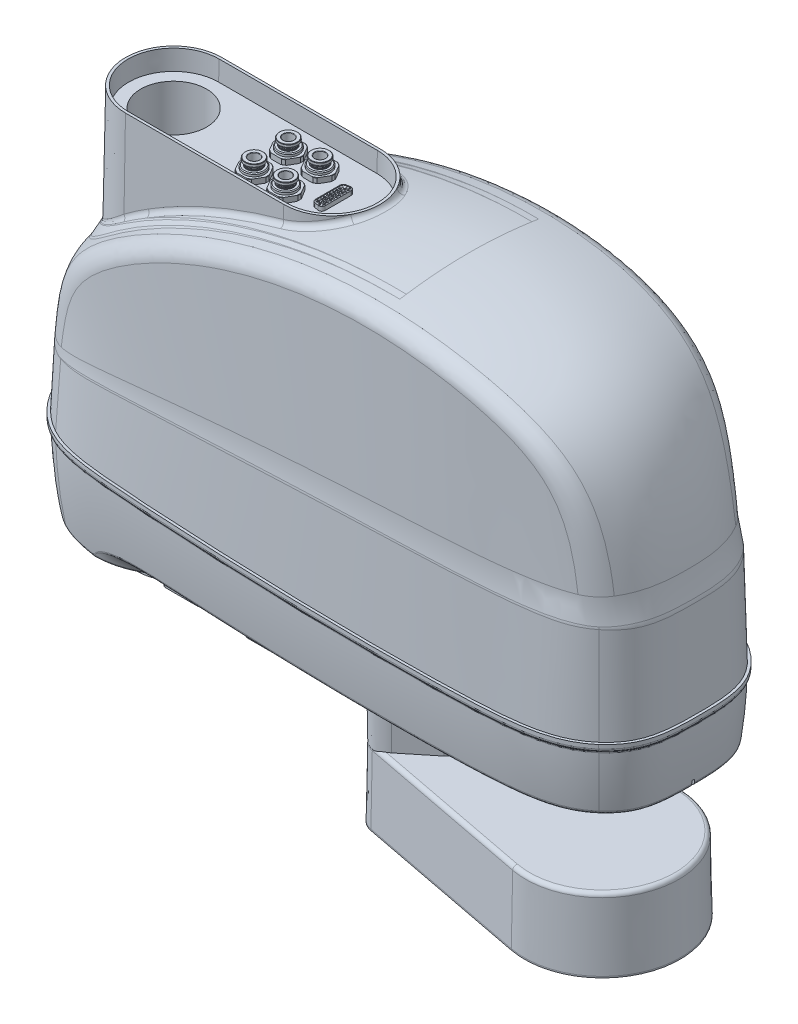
SolidWorks part; units mm, degrees
ref_plane "前视基准面" through (0, 0, 0) normal (0, 0, 1) x (1, 0, 0)
ref_plane "上视基准面" through (0, 0, 0) normal (0, 1, 0) x (1, 0, 0)
ref_plane "右视基准面" through (0, 0, 0) normal (1, 0, 0) x (0, 0, -1)
imported_body "输入1"
imported_body "输入2"
imported_body "输入3"
imported_body "输入4"
imported_body "输入5"
imported_body "输入6"
imported_body "输入7"
imported_body "输入8"
imported_body "输入9"
imported_body "输入10"
sketch "草图1" plane through (0, 249.0001, 0) normal (0, 1, 0) x (1, 0, 0)
  circle A0 centre (-325, 0) radius 25
  dimension "D1" = 50
extrude "切除-拉伸1" cut sketch "草图1" against normal blind 136
